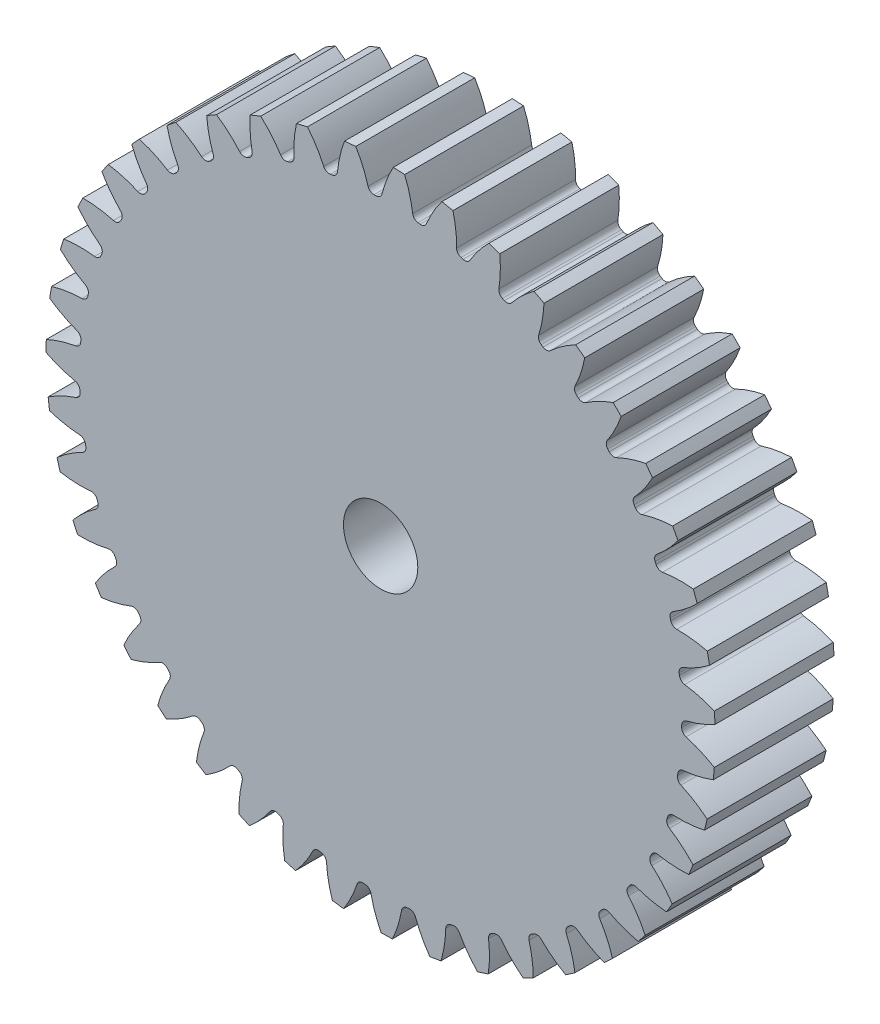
SolidWorks part; units mm, degrees
ref_plane "Front" through (0, 0, 0) normal (0, 0, 1) x (1, 0, 0)
ref_plane "Top" through (0, 0, 0) normal (0, 1, 0) x (1, 0, 0)
ref_plane "Right" through (0, 0, 0) normal (1, 0, 0) x (0, 0, -1)
sketch "Sketch3" plane through (0, 0, 0) normal (0, 0, 1) x (1, 0, 0)
  circle A0 centre (0, 0) radius 285.75
  dimension "od" = 571.5
extrude "gearBody" add sketch "Sketch3" along normal blind 101.6
sketch "Sketch2" plane through (0, 0, 0) normal (0, 0, 1) x (1, 0, 0)
  line L0 (0, 0) -> (237.0518, 98.1901) construction
  line L1 (285.1618, -21.343) -> (0, 0) construction
  line L2 (0, 0) -> (36.3143, 0) construction
  line L3 (273.0049, 4.9625) -> (272.6429, -14.9047) construction
  line L5 (272.8239, -4.9711) -> (0, 0) construction
  line L7 (0, 0) -> (256.5831, 0) construction
  arc A0 (256.583, 0.1975) -> (256.4055, -9.5447) centre (0, 0) ccw construction
  arc A1 (285.5448, 10.8262) -> (284.9609, -21.2214) centre (0, 0) ccw construction
  arc A2 (273.0049, 4.9625) -> (272.6429, -14.9047) centre (0, 0) ccw construction
  arc A3 (257.1134, -5.6288) -> (257.1478, -3.7416) centre (0, 0) ccw
  arc A4 (285.1618, -21.343) -> (260.8565, -10.7106) centre (233.3174, -106.7607) ccw
  arc A5 (285.1618, -21.343) -> (285.75, 10.9404) centre (0, 0) ccw
  arc A6 (285.75, 10.9404) -> (261.0735, 1.2005) centre (237.0518, 98.1901) cw
  arc A7 (257.1478, -3.7416) -> (261.0735, 1.2005) centre (262.3161, -3.8168) cw
  arc A8 (260.8565, -10.7106) -> (257.1134, -5.6288) centre (262.2811, -5.7419) cw
  point P6 (285.75, 10.9404)
  point P22 (285.1618, -21.343)
  dimension "baseDia" = 513.1661
  dimension "od" = 571.5
  dimension "pd" = 546.1
  dimension "rd" = 514.35
  dimension "rFillet" = 5.1689
  dimension "pointX" = 285.75
  dimension "pointY" = 10.9404
  dimension "CTT" = 19.8672
  dimension "flankCenterAngle" = 22.5
extrude "toothCut" cut sketch "Sketch2" along normal through all
pattern_circular "CirPattern1" count 43 over 360 about axis through (0, 0, 0) along (0, 0, 1) of "toothCut"
sketch "hub1Dia" plane through (0, 0, 0) normal (0, 0, -1) x (-1, 0, 0)
  circle A0 centre (0, 0) radius 12.7
  dimension "hub1Dia" = 25.4
sketch "hub2Dia" plane through (0, 0, 101.6) normal (0, 0, 1) x (1, 0, 0)
  circle A0 centre (0, 0) radius 12.7
  dimension "hub2dia" = 25.4
sketch "boreDia" plane through (0, 0, 0) normal (0, 0, 1) x (1, 0, 0)
  circle A0 centre (0, 0) radius 31.75
  dimension "boreDia" = 63.5
extrude "bore" cut sketch "boreDia" against normal mid plane 25400
